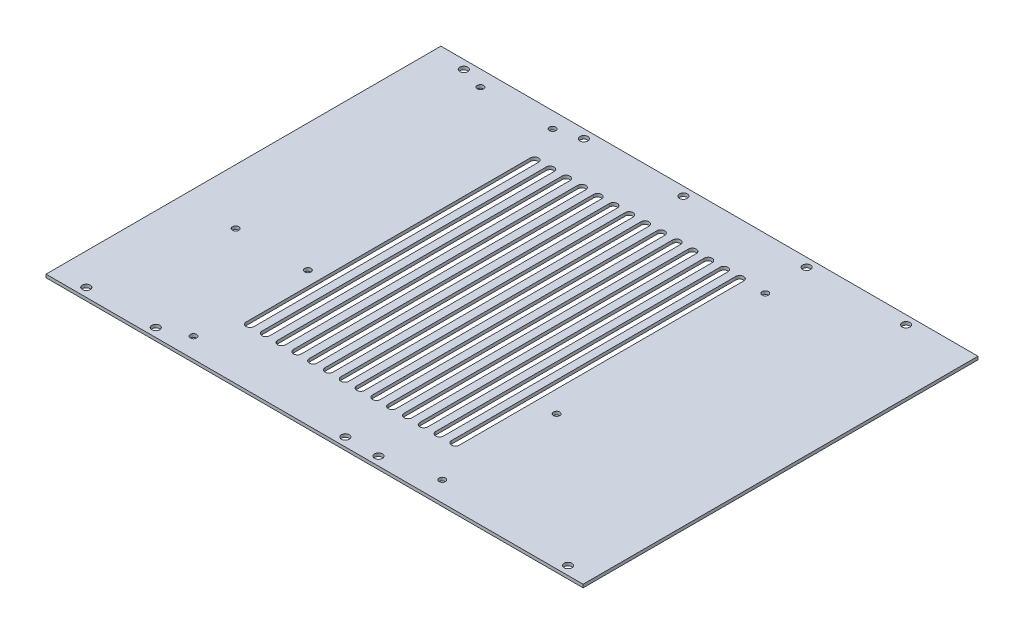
SolidWorks part; units mm, degrees
ref_plane "Front Plane" through (0, 0, 0) normal (0, 0, 1) x (1, 0, 0)
ref_plane "Top Plane" through (0, 0, 0) normal (0, 1, 0) x (1, 0, 0)
ref_plane "Right Plane" through (0, 0, 0) normal (1, 0, 0) x (0, 0, -1)
sketch "Sketch1" plane through (0, 0, 0) normal (0, 1, 0) x (1, 0, 0)
  line L0 (-77.9171, 92.0939) -> (-77.9171, -87.9061) construction
  line L1 (-170, 125) -> (170, 125)
  line L2 (-170, 125) -> (-170, -125)
  line L3 (-170, -125) -> (170, -125)
  line L4 (170, 125) -> (170, -125)
  line L5 (-170, 125) -> (170, -125) construction
  line L6 (-170, -125) -> (170, 125) construction
  line L7 (-75.4171, 92.0939) -> (-75.4171, -87.9061)
  line L8 (-80.4171, 92.0939) -> (-80.4171, -87.9061)
  line L10 (-67.9171, 92.0939) -> (-67.9171, -87.9061) construction
  line L11 (-65.4171, 92.0939) -> (-65.4171, -87.9061)
  line L12 (-70.4171, 92.0939) -> (-70.4171, -87.9061)
  line L13 (-57.9171, 92.0939) -> (-57.9171, -87.9061) construction
  line L14 (-55.4171, 92.0939) -> (-55.4171, -87.9061)
  line L15 (-60.4171, 92.0939) -> (-60.4171, -87.9061)
  line L16 (-47.9171, 92.0939) -> (-47.9171, -87.9061) construction
  line L17 (-45.4171, 92.0939) -> (-45.4171, -87.9061)
  line L18 (-50.4171, 92.0939) -> (-50.4171, -87.9061)
  line L19 (-37.9171, 92.0939) -> (-37.9171, -87.9061) construction
  line L20 (-35.4171, 92.0939) -> (-35.4171, -87.9061)
  line L21 (-40.4171, 92.0939) -> (-40.4171, -87.9061)
  line L22 (-27.9171, 92.0939) -> (-27.9171, -87.9061) construction
  line L23 (-25.4171, 92.0939) -> (-25.4171, -87.9061)
  line L24 (-30.4171, 92.0939) -> (-30.4171, -87.9061)
  line L25 (-17.9171, 92.0939) -> (-17.9171, -87.9061) construction
  line L26 (-15.4171, 92.0939) -> (-15.4171, -87.9061)
  line L27 (-20.4171, 92.0939) -> (-20.4171, -87.9061)
  line L28 (-7.9171, 92.0939) -> (-7.9171, -87.9061) construction
  line L29 (-5.4171, 92.0939) -> (-5.4171, -87.9061)
  line L30 (-10.4171, 92.0939) -> (-10.4171, -87.9061)
  line L31 (2.0829, 92.0939) -> (2.0829, -87.9061) construction
  line L32 (4.5829, 92.0939) -> (4.5829, -87.9061)
  line L33 (-0.4171, 92.0939) -> (-0.4171, -87.9061)
  line L34 (12.0829, 92.0939) -> (12.0829, -87.9061) construction
  line L35 (14.5829, 92.0939) -> (14.5829, -87.9061)
  line L36 (9.5829, 92.0939) -> (9.5829, -87.9061)
  line L37 (22.0829, 92.0939) -> (22.0829, -87.9061) construction
  line L38 (24.5829, 92.0939) -> (24.5829, -87.9061)
  line L39 (19.5829, 92.0939) -> (19.5829, -87.9061)
  line L40 (32.0829, 92.0939) -> (32.0829, -87.9061) construction
  line L41 (34.5829, 92.0939) -> (34.5829, -87.9061)
  line L42 (29.5829, 92.0939) -> (29.5829, -87.9061)
  line L43 (42.0829, 92.0939) -> (42.0829, -87.9061) construction
  line L44 (44.5829, 92.0939) -> (44.5829, -87.9061)
  line L45 (39.5829, 92.0939) -> (39.5829, -87.9061)
  line L46 (52.0829, 92.0939) -> (52.0829, -87.9061) construction
  line L47 (54.5829, 92.0939) -> (54.5829, -87.9061)
  line L48 (49.5829, 92.0939) -> (49.5829, -87.9061)
  circle A0 centre (-135, 115) radius 2
  circle A1 centre (-89.28, 115) radius 2
  circle A2 centre (68.2, 92.14) radius 2
  circle A3 centre (-135, -39.94) radius 2
  circle A4 centre (-89.28, -39.94) radius 2
  circle A5 centre (68.2, -39.94) radius 2
  circle A6 centre (-89.28, -112.33) radius 2
  circle A7 centre (68.2, -112.33) radius 2
  circle A8 centre (130, 119.5) radius 2.5
  circle A9 centre (67, 119.5) radius 2.5
  circle A10 centre (-11, 119.5) radius 2.5
  circle A11 centre (-74, 119.5) radius 2.5
  circle A12 centre (-106, -119.5) radius 2.5
  circle A13 centre (14, -119.5) radius 2.5
  circle A14 centre (35, -119.5) radius 2.5
  circle A15 centre (155, -119.5) radius 2.5
  arc A16 (-75.4171, 92.0939) -> (-80.4171, 92.0939) centre (-77.9171, 92.0939) ccw
  arc A17 (-80.4171, -87.9061) -> (-75.4171, -87.9061) centre (-77.9171, -87.9061) ccw
  arc A18 (-65.4171, 92.0939) -> (-70.4171, 92.0939) centre (-67.9171, 92.0939) ccw
  arc A19 (-70.4171, -87.9061) -> (-65.4171, -87.9061) centre (-67.9171, -87.9061) ccw
  arc A20 (-55.4171, 92.0939) -> (-60.4171, 92.0939) centre (-57.9171, 92.0939) ccw
  arc A21 (-60.4171, -87.9061) -> (-55.4171, -87.9061) centre (-57.9171, -87.9061) ccw
  arc A22 (-45.4171, 92.0939) -> (-50.4171, 92.0939) centre (-47.9171, 92.0939) ccw
  arc A23 (-50.4171, -87.9061) -> (-45.4171, -87.9061) centre (-47.9171, -87.9061) ccw
  arc A24 (-35.4171, 92.0939) -> (-40.4171, 92.0939) centre (-37.9171, 92.0939) ccw
  arc A25 (-40.4171, -87.9061) -> (-35.4171, -87.9061) centre (-37.9171, -87.9061) ccw
  arc A26 (-25.4171, 92.0939) -> (-30.4171, 92.0939) centre (-27.9171, 92.0939) ccw
  arc A27 (-30.4171, -87.9061) -> (-25.4171, -87.9061) centre (-27.9171, -87.9061) ccw
  arc A28 (-15.4171, 92.0939) -> (-20.4171, 92.0939) centre (-17.9171, 92.0939) ccw
  arc A29 (-20.4171, -87.9061) -> (-15.4171, -87.9061) centre (-17.9171, -87.9061) ccw
  arc A30 (-5.4171, 92.0939) -> (-10.4171, 92.0939) centre (-7.9171, 92.0939) ccw
  arc A31 (-10.4171, -87.9061) -> (-5.4171, -87.9061) centre (-7.9171, -87.9061) ccw
  arc A32 (4.5829, 92.0939) -> (-0.4171, 92.0939) centre (2.0829, 92.0939) ccw
  arc A33 (-0.4171, -87.9061) -> (4.5829, -87.9061) centre (2.0829, -87.9061) ccw
  arc A34 (14.5829, 92.0939) -> (9.5829, 92.0939) centre (12.0829, 92.0939) ccw
  arc A35 (9.5829, -87.9061) -> (14.5829, -87.9061) centre (12.0829, -87.9061) ccw
  arc A36 (24.5829, 92.0939) -> (19.5829, 92.0939) centre (22.0829, 92.0939) ccw
  arc A37 (19.5829, -87.9061) -> (24.5829, -87.9061) centre (22.0829, -87.9061) ccw
  arc A38 (34.5829, 92.0939) -> (29.5829, 92.0939) centre (32.0829, 92.0939) ccw
  arc A39 (29.5829, -87.9061) -> (34.5829, -87.9061) centre (32.0829, -87.9061) ccw
  arc A40 (44.5829, 92.0939) -> (39.5829, 92.0939) centre (42.0829, 92.0939) ccw
  arc A41 (39.5829, -87.9061) -> (44.5829, -87.9061) centre (42.0829, -87.9061) ccw
  arc A42 (54.5829, 92.0939) -> (49.5829, 92.0939) centre (52.0829, 92.0939) ccw
  arc A43 (49.5829, -87.9061) -> (54.5829, -87.9061) centre (52.0829, -87.9061) ccw
  circle A44 centre (-150, -119.5) radius 2.5
  circle A45 centre (-150, 119.5) radius 2.5
  point P0 (0, 0)
  point P26 (91.6308, 0.1671)
  point P35 (-77.9171, 2.0939)
  point P38 (-48.3692, 0.1671)
  point P51 (-67.9171, 2.0939)
  point P58 (-57.9171, 2.0939)
  point P65 (-47.9171, 2.0939)
  point P72 (-37.9171, 2.0939)
  point P79 (-27.9171, 2.0939)
  point P86 (-17.9171, 2.0939)
  point P93 (-7.9171, 2.0939)
  point P100 (2.0829, 2.0939)
  point P107 (12.0829, 2.0939)
  point P114 (22.0829, 2.0939)
  point P121 (32.0829, 2.0939)
  point P128 (42.0829, 2.0939)
  point P135 (52.0829, 2.0939)
  point P140 (0, 0)
  point P143 (0, 0)
  point P144 (0, 0)
  dimension "D3" = 35
  dimension "D6" = 4
  dimension "D9" = 154.94
  dimension "D11" = 227.33
  dimension "D12" = 40
  dimension "D13" = 5
  dimension "D16" = 64
  dimension "D23" = 14
  dimension "D24" = 5
  dimension "D28" = 2.5
  dimension "D1" = 340
  dimension "D2" = 250
  dimension "D4" = 10
  dimension "D5" = 45.72
  dimension "D7" = 32.86
  dimension "D8" = 203.2
  dimension "D10" = 203.2
  dimension "D14" = 5.5
  dimension "D15" = 63
  dimension "D17" = 239
  dimension "D18" = 120
  dimension "D19" = 15
  dimension "D20" = 96
  dimension "D21" = 63
  dimension "D22" = 120
  dimension "D26" = 5
  dimension "D27" = 180
  dimension "D29" = 20
  dimension "D25" = 2
extrude "Boss-Extrude1" add sketch "Sketch1" along normal blind 2
